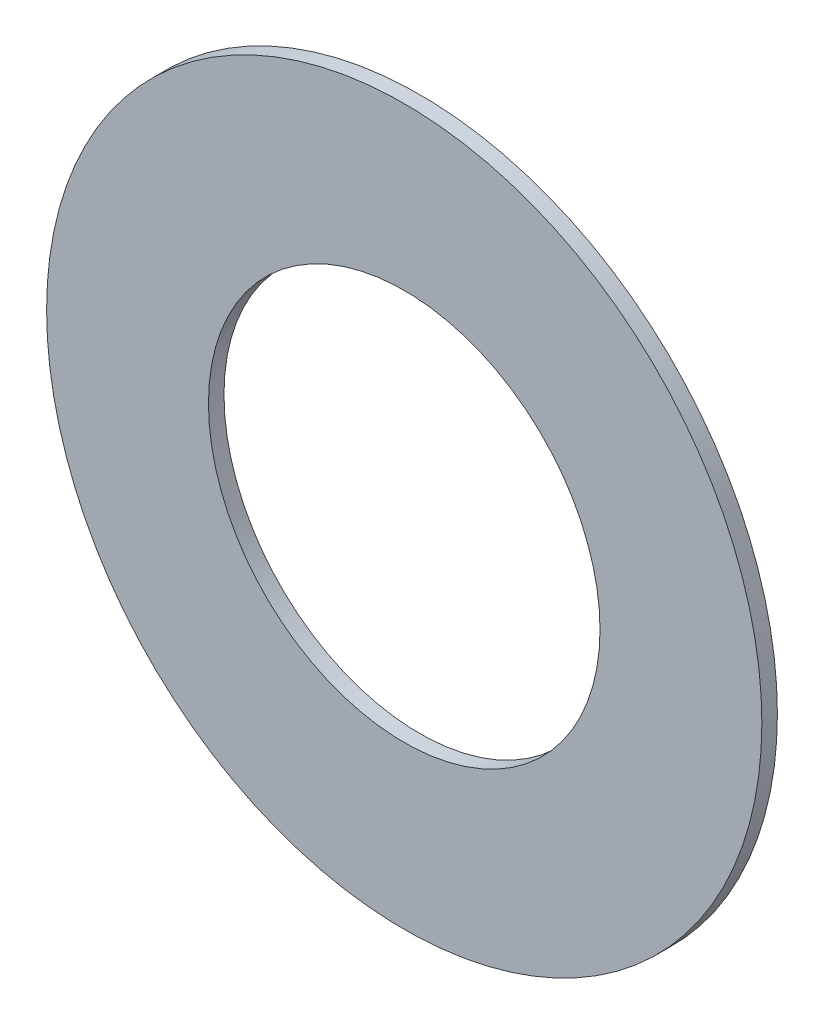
SolidWorks part; units mm, degrees
ref_plane "Front Plane" through (0, 0, 0) normal (1, 0, 0) x (0, 1, 0)
ref_plane "Top Plane" through (0, 0, 0) normal (0, 0, 1) x (0, 1, 0)
ref_plane "Right Plane" through (0, 0, 0) normal (0, 1, 0) x (-1, 0, 0)
sketch "sk 3.5in Nut" plane through (0, 0, 0) normal (0, 0, 1) x (0, 1, 0)
  line B0 (38.7698, -67.1513) -> (77.5396, 0)
  line B1 (77.5396, 0) -> (38.7698, 67.1513)
  line B2 (38.7698, 67.1513) -> (-38.7698, 67.1513)
  line B3 (-38.7698, 67.1513) -> (-77.5396, 0)
  line B4 (-77.5396, 0) -> (-38.7698, -67.1513)
  line B5 (-38.7698, -67.1513) -> (38.7698, -67.1513)
  circle B6 centre (0, 0) radius 44.45
  circle B7 centre (0, 0) radius 67.1512 construction
sketch_block_instance "3.5in nut-1"
sketch_block "3.5in nut"
sketch "Sketch4"
sketch_block_instance "3.0in nut-1"
sketch_block "3.0in nut" parameters "D1"=76.2, "D2"=115.57
sketch "Sketch2" plane through (0, 0, 0) normal (0, 0, 1) x (0, 1, 0)
  circle A0 centre (0, 0) radius 66.7244 construction
  circle A2 centre (0, 0) radius 40.005
  circle A3 centre (0, 0) radius 73.0744
  dimension "D2" = 80.01
  dimension "D1" = 6.35
extrude "Boss-Extrude1" add sketch "Sketch2" along normal mid plane 3.175
